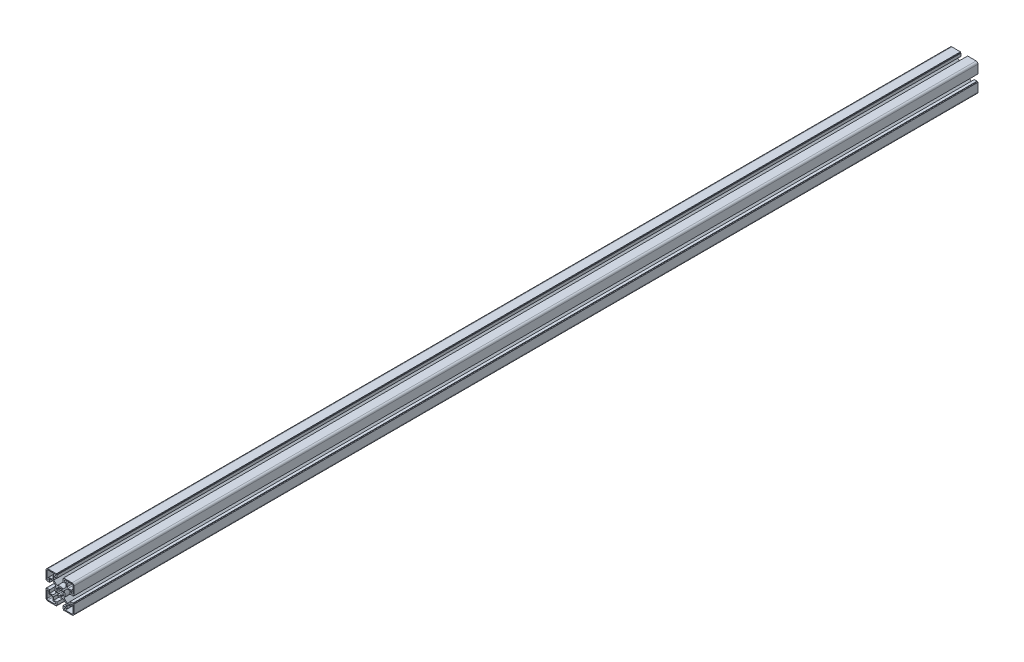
SolidWorks part; units mm, degrees
ref_plane "Front Plane" through (0, 0, 0) normal (0, 0, 1) x (1, 0, 0)
ref_plane "Top Plane" through (0, 0, 0) normal (0, 1, 0) x (1, 0, 0)
ref_plane "Right Plane" through (0, 0, 0) normal (1, 0, 0) x (0, 0, -1)
sketch "Sketch1" plane through (0, 0, 0) normal (0, 0, 1) x (1, 0, 0)
  line L2 (-19.5072, 22.5044) -> (-5.7912, 22.5044)
  line L3 (-5.7912, 22.5044) -> (-5.7912, 21.0058)
  line L4 (-5.7912, 21.0058) -> (-5.0038, 21.0058)
  line L6 (-5.0038, 21.0058) -> (-5.0038, 16.51)
  line L7 (-5.0038, 16.51) -> (-10.0457, 16.51)
  line L8 (-10.0457, 16.51) -> (-10.0457, 11.6801)
  line L9 (-10.0457, 11.6801) -> (-4.781, 6.4154)
  line L11 (-11.6801, 10.0457) -> (-6.4154, 4.781)
  line L12 (-16.51, 10.0457) -> (-11.6801, 10.0457)
  line L13 (-16.51, 5.0038) -> (-16.51, 10.0457)
  line L14 (-21.0058, 5.0038) -> (-16.51, 5.0038)
  line L15 (-21.0058, 5.7912) -> (-21.0058, 5.0038)
  line L16 (-22.5044, 5.7912) -> (-21.0058, 5.7912)
  line L17 (-22.5044, 19.5072) -> (-22.5044, 5.7912)
  line L18 (-18.0086, 11.5443) -> (-13.0429, 11.5443)
  line L19 (-18.0086, 11.5443) -> (-18.0086, 8.7884)
  line L20 (-11.5443, 18.0086) -> (-11.5443, 13.0429)
  line L21 (-21.0058, 19.5072) -> (-21.0058, 8.7884)
  line L23 (-11.5443, 18.0086) -> (-8.7884, 18.0086)
  line L24 (-19.5072, 21.0058) -> (-8.7884, 21.0058)
  line L25 (1.1893, 5.9789) -> (0.9762, 4.9077)
  line L26 (-1.1893, 5.9789) -> (-0.9762, 4.9077)
  line L27 (5.0686, 3.3868) -> (4.1605, 2.78)
  line L28 (3.3868, 5.0686) -> (2.78, 4.1605)
  line L29 (5.9789, -1.1893) -> (4.9077, -0.9762)
  line L30 (5.9789, 1.1893) -> (4.9077, 0.9762)
  line L31 (3.3868, -5.0686) -> (2.78, -4.1605)
  line L32 (5.0686, -3.3868) -> (4.1605, -2.78)
  line L33 (-1.1893, -5.9789) -> (-0.9762, -4.9077)
  line L34 (1.1893, -5.9789) -> (0.9762, -4.9077)
  line L35 (-5.0686, -3.3868) -> (-4.1605, -2.78)
  line L36 (-3.3868, -5.0686) -> (-2.78, -4.1605)
  line L37 (-5.9789, 1.1893) -> (-4.9077, 0.9762)
  line L38 (-5.9789, -1.1893) -> (-4.9077, -0.9762)
  line L39 (-3.3868, 5.0686) -> (-2.78, 4.1605)
  line L40 (-5.0686, 3.3868) -> (-4.1605, 2.78)
  line L41 (11.5443, 18.0086) -> (8.7884, 18.0086)
  line L42 (19.5072, 21.0058) -> (8.7884, 21.0058)
  line L43 (19.5072, 22.5044) -> (5.7912, 22.5044)
  line L44 (5.7912, 22.5044) -> (5.7912, 21.0058)
  line L45 (5.7912, 21.0058) -> (5.0038, 21.0058)
  line L46 (5.0038, 21.0058) -> (5.0038, 16.51)
  line L47 (5.0038, 16.51) -> (10.0457, 16.51)
  line L48 (10.0457, 16.51) -> (10.0457, 11.6801)
  line L49 (10.0457, 11.6801) -> (4.781, 6.4154)
  line L50 (11.6801, 10.0457) -> (6.4154, 4.781)
  line L51 (21.0058, 19.5072) -> (21.0058, 8.7884)
  line L52 (11.5443, 18.0086) -> (11.5443, 13.0429)
  line L53 (18.0086, 11.5443) -> (18.0086, 8.7884)
  line L54 (18.0086, 11.5443) -> (13.0429, 11.5443)
  line L55 (22.5044, 19.5072) -> (22.5044, 5.7912)
  line L56 (22.5044, 5.7912) -> (21.0058, 5.7912)
  line L57 (21.0058, 5.7912) -> (21.0058, 5.0038)
  line L58 (21.0058, 5.0038) -> (16.51, 5.0038)
  line L59 (16.51, 5.0038) -> (16.51, 10.0457)
  line L60 (16.51, 10.0457) -> (11.6801, 10.0457)
  line L61 (16.51, -10.0457) -> (11.6801, -10.0457)
  line L62 (16.51, -5.0038) -> (16.51, -10.0457)
  line L63 (21.0058, -5.0038) -> (16.51, -5.0038)
  line L64 (21.0058, -5.7912) -> (21.0058, -5.0038)
  line L65 (22.5044, -5.7912) -> (21.0058, -5.7912)
  line L66 (22.5044, -19.5072) -> (22.5044, -5.7912)
  line L67 (18.0086, -11.5443) -> (13.0429, -11.5443)
  line L68 (18.0086, -11.5443) -> (18.0086, -8.7884)
  line L69 (11.5443, -18.0086) -> (11.5443, -13.0429)
  line L70 (21.0058, -19.5072) -> (21.0058, -8.7884)
  line L71 (11.6801, -10.0457) -> (6.4154, -4.781)
  line L72 (10.0457, -11.6801) -> (4.781, -6.4154)
  line L73 (10.0457, -16.51) -> (10.0457, -11.6801)
  line L74 (5.0038, -16.51) -> (10.0457, -16.51)
  line L75 (5.0038, -21.0058) -> (5.0038, -16.51)
  line L76 (5.7912, -21.0058) -> (5.0038, -21.0058)
  line L77 (5.7912, -22.5044) -> (5.7912, -21.0058)
  line L78 (19.5072, -22.5044) -> (5.7912, -22.5044)
  line L79 (19.5072, -21.0058) -> (8.7884, -21.0058)
  line L80 (11.5443, -18.0086) -> (8.7884, -18.0086)
  line L81 (-11.5443, -18.0086) -> (-8.7884, -18.0086)
  line L82 (-19.5072, -21.0058) -> (-8.7884, -21.0058)
  line L83 (-19.5072, -22.5044) -> (-5.7912, -22.5044)
  line L84 (-5.7912, -22.5044) -> (-5.7912, -21.0058)
  line L85 (-5.7912, -21.0058) -> (-5.0038, -21.0058)
  line L86 (-5.0038, -21.0058) -> (-5.0038, -16.51)
  line L87 (-5.0038, -16.51) -> (-10.0457, -16.51)
  line L88 (-10.0457, -16.51) -> (-10.0457, -11.6801)
  line L89 (-10.0457, -11.6801) -> (-4.781, -6.4154)
  line L90 (-11.6801, -10.0457) -> (-6.4154, -4.781)
  line L91 (-21.0058, -19.5072) -> (-21.0058, -8.7884)
  line L92 (-11.5443, -18.0086) -> (-11.5443, -13.0429)
  line L93 (-18.0086, -11.5443) -> (-18.0086, -8.7884)
  line L94 (-18.0086, -11.5443) -> (-13.0429, -11.5443)
  line L95 (-22.5044, -19.5072) -> (-22.5044, -5.7912)
  line L96 (-22.5044, -5.7912) -> (-21.0058, -5.7912)
  line L97 (-21.0058, -5.7912) -> (-21.0058, -5.0038)
  line L98 (-21.0058, -5.0038) -> (-16.51, -5.0038)
  line L99 (-16.51, -5.0038) -> (-16.51, -10.0457)
  line L100 (-16.51, -10.0457) -> (-11.6801, -10.0457)
  arc A0 (-22.5044, 19.5072) -> (-19.5072, 22.5044) centre (-19.5072, 19.5072) cw
  arc A1 (-21.0058, 8.7884) -> (-18.0086, 8.7884) centre (-19.5072, 8.7884) ccw
  arc A2 (-21.0058, 19.5072) -> (-19.5072, 21.0058) centre (-19.5072, 19.5072) cw
  arc A3 (-8.7884, 21.0058) -> (-8.7884, 18.0086) centre (-8.7884, 19.5072) cw
  arc A4 (-11.5443, 13.0429) -> (-13.0429, 11.5443) centre (-13.0429, 13.0429) cw
  arc A5 (6.4154, -4.781) -> (6.4154, 4.781) centre (0, 0) ccw
  arc A6 (0.9762, 4.9077) -> (-0.9762, 4.9077) centre (0, 0) ccw
  arc A7 (-5.0686, 3.3868) -> (-5.9789, 1.1893) centre (0, 0) ccw
  arc A8 (4.1605, 2.78) -> (2.78, 4.1605) centre (0, 0) ccw
  arc A9 (4.9077, -0.9762) -> (4.9077, 0.9762) centre (0, 0) ccw
  arc A10 (2.78, -4.1605) -> (4.1605, -2.78) centre (0, 0) ccw
  arc A11 (-0.9762, -4.9077) -> (0.9762, -4.9077) centre (0, 0) ccw
  arc A12 (-4.1605, -2.78) -> (-2.78, -4.1605) centre (0, 0) ccw
  arc A13 (-4.9077, 0.9762) -> (-4.9077, -0.9762) centre (0, 0) ccw
  arc A14 (-2.78, 4.1605) -> (-4.1605, 2.78) centre (0, 0) ccw
  arc A15 (-5.9789, -1.1893) -> (-5.0686, -3.3868) centre (0, 0) ccw
  arc A16 (-3.3868, -5.0686) -> (-1.1893, -5.9789) centre (0, 0) ccw
  arc A17 (1.1893, -5.9789) -> (3.3868, -5.0686) centre (0, 0) ccw
  arc A18 (5.0686, -3.3868) -> (5.9789, -1.1893) centre (0, 0) ccw
  arc A19 (5.9789, 1.1893) -> (5.0686, 3.3868) centre (0, 0) ccw
  arc A20 (3.3868, 5.0686) -> (1.1893, 5.9789) centre (0, 0) ccw
  arc A21 (-1.1893, 5.9789) -> (-3.3868, 5.0686) centre (0, 0) ccw
  arc A22 (8.7884, 21.0058) -> (8.7884, 18.0086) centre (8.7884, 19.5072) ccw
  arc A23 (21.0058, 19.5072) -> (19.5072, 21.0058) centre (19.5072, 19.5072) ccw
  arc A24 (22.5044, 19.5072) -> (19.5072, 22.5044) centre (19.5072, 19.5072) ccw
  arc A25 (11.5443, 13.0429) -> (13.0429, 11.5443) centre (13.0429, 13.0429) ccw
  arc A26 (21.0058, 8.7884) -> (18.0086, 8.7884) centre (19.5072, 8.7884) cw
  arc A27 (21.0058, -8.7884) -> (18.0086, -8.7884) centre (19.5072, -8.7884) ccw
  arc A28 (11.5443, -13.0429) -> (13.0429, -11.5443) centre (13.0429, -13.0429) cw
  arc A29 (22.5044, -19.5072) -> (19.5072, -22.5044) centre (19.5072, -19.5072) cw
  arc A30 (21.0058, -19.5072) -> (19.5072, -21.0058) centre (19.5072, -19.5072) cw
  arc A31 (8.7884, -21.0058) -> (8.7884, -18.0086) centre (8.7884, -19.5072) cw
  arc A32 (-8.7884, -21.0058) -> (-8.7884, -18.0086) centre (-8.7884, -19.5072) ccw
  arc A33 (-21.0058, -19.5072) -> (-19.5072, -21.0058) centre (-19.5072, -19.5072) ccw
  arc A34 (-22.5044, -19.5072) -> (-19.5072, -22.5044) centre (-19.5072, -19.5072) ccw
  arc A35 (-11.5443, -13.0429) -> (-13.0429, -11.5443) centre (-13.0429, -13.0429) ccw
  arc A36 (-21.0058, -8.7884) -> (-18.0086, -8.7884) centre (-19.5072, -8.7884) cw
  arc A37 (4.781, 6.4154) -> (-4.781, 6.4154) centre (0, 0) ccw
  arc A38 (-4.781, -6.4154) -> (4.781, -6.4154) centre (0, 0) ccw
  arc A39 (-6.4154, 4.781) -> (-6.4154, -4.781) centre (0, 0) ccw
extrude "Boss-Extrude1" add sketch "Sketch1" against normal up to surface (1455.801 mm away)
